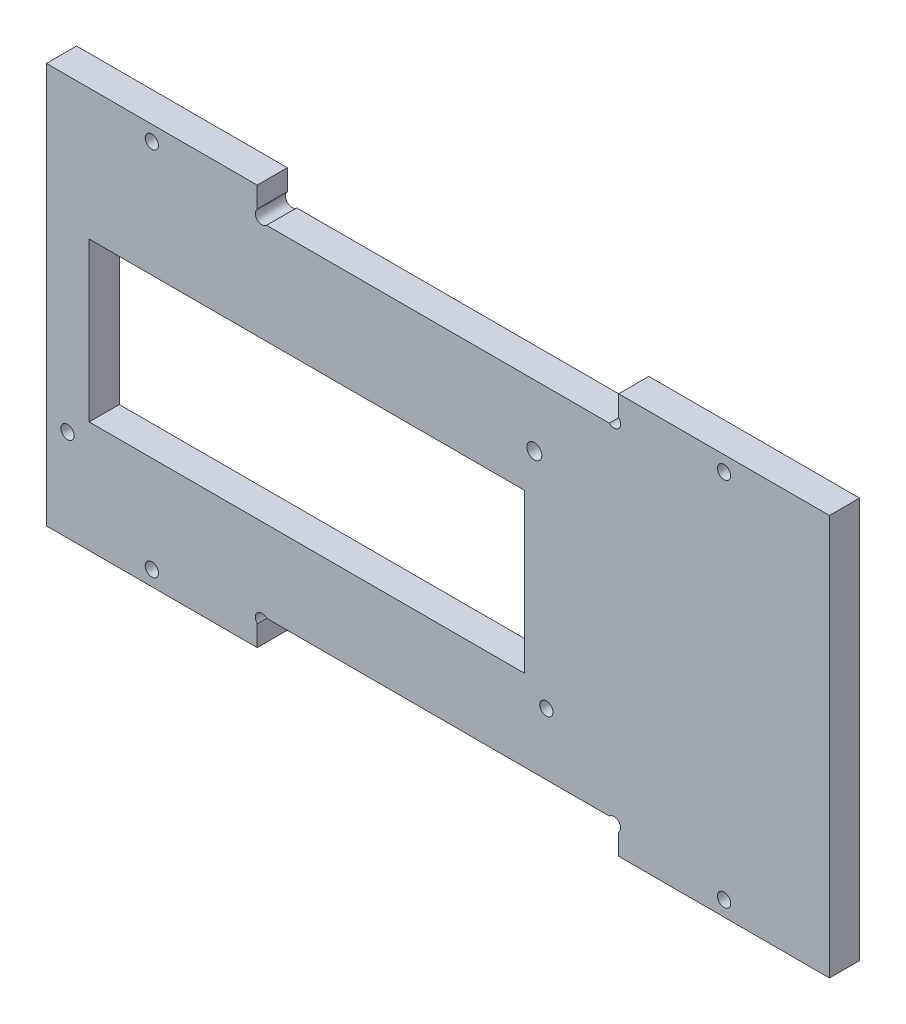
SolidWorks part; units mm, degrees
ref_plane "Plan de face" through (0, 0, 0) normal (0, 0, 1) x (1, 0, 0)
ref_plane "Plan de dessus" through (0, 0, 0) normal (0, 1, 0) x (1, 0, 0)
ref_plane "Plan de droite" through (0, 0, 0) normal (1, 0, 0) x (0, 0, -1)
sketch "Esquisse1" plane through (0, 0, 0) normal (0, 0, 1) x (1, 0, 0)
  line L1 (0, 0) -> (130, 0)
  line L2 (0, 0) -> (0, 66.5)
  line L3 (0, 66.5) -> (130, 66.5)
  line L4 (130, 0) -> (130, 66.5)
  dimension "D1" = 130
  dimension "D2" = 66.5
extrude "Boss.-Extru.1" add sketch "Esquisse1" along normal blind 5
sketch "Esquisse2" plane through (0, 0, 5) normal (0, 0, 1) x (1, 0, 0)
  line L0 (0, 66.5) -> (0, 0) construction
  line L1 (130, 66.5) -> (0, 66.5) construction
  line L2 (83, 15.25) -> (3.5, 15.25) construction
  line L3 (5.5, 51.25) -> (81, 51.25) construction
  circle A0 centre (81, 51.25) radius 1.25
  circle A2 centre (83, 15.25) radius 1.1
  circle A3 centre (3.5, 15.25) radius 1.1
  point P2 (5.5, 51.25)
  dimension "D1" = 2.5
  dimension "D2" = 79.5
  dimension "D6" = 2.2
  dimension "D7" = 2.2
  dimension "D3" = 36
  dimension "D4" = 81
  dimension "D5" = 15.25
  dimension "D8" = 75.5
  dimension "D9" = 3.5
extrude "Enlèv. mat.-Extru.1" cut sketch "Esquisse2" against normal up to next
sketch "Esquisse3" plane through (0, 0, 5) normal (0, 0, 1) x (1, 0, 0)
  line L1 (79.4, 18.5) -> (7.1, 18.5)
  line L2 (79.4, 18.5) -> (79.4, 44.8)
  line L3 (79.4, 44.8) -> (7.1, 44.8)
  line L4 (7.1, 18.5) -> (7.1, 44.8)
  circle A1 centre (81, 51.25) radius 1.25 construction
  dimension "D3" = 1.6
  dimension "D1" = 26.3
  dimension "D2" = 72.3
  dimension "D4" = 6.45
extrude "Enlèv. mat.-Extru.2" cut sketch "Esquisse3" against normal up to next
sketch "Esquisse5" plane through (0, 0, 5) normal (0, 0, 1) x (1, 0, 0)
  circle A0 centre (83, 15.25) radius 2
  circle A1 centre (81, 51.25) radius 2
  circle A2 centre (3.5, 15.25) radius 2
  dimension "D1" = 4
  dimension "D2" = 4
  dimension "D3" = 4
extrude "Enlèv. mat.-Extru.3" [suppressed] cut sketch "Esquisse5" against normal blind 1.5
sketch "Esquisse6" plane through (0, 0, 5) normal (0, 0, 1) x (1, 0, 0)
  line L0 (0, 0) -> (130, 0) construction
  line L1 (95, 0) -> (35, 0)
  line L2 (95, 0) -> (95, 5)
  line L3 (95, 5) -> (35, 5)
  line L4 (35, 0) -> (35, 5)
  line L5 (130, 66.5) -> (0, 66.5) construction
  line L6 (95, 66.5) -> (35, 66.5)
  line L7 (95, 66.5) -> (95, 61.5)
  line L8 (95, 61.5) -> (35, 61.5)
  line L9 (35, 66.5) -> (35, 61.5)
  line L10 (130, 0) -> (130, 66.5) construction
  dimension "D1" = 5
  dimension "D2" = 5
  dimension "D3" = 60
  dimension "D4" = 60
  dimension "D5" = 35
  dimension "D6" = 35
extrude "Enlèv. mat.-Extru.4" cut sketch "Esquisse6" against normal up to next
sketch "Esquisse7" plane through (0, 0, 5) normal (0, 0, 1) x (1, 0, 0)
  line L0 (35, 5) -> (53.0632, -13.0632) construction
  line L1 (95, 5) -> (72.5313, -17.4687) construction
  line L2 (35, 61.5) -> (56.3913, 82.8913) construction
  line L3 (95, 61.5) -> (70.0123, 86.4877) construction
  line L4 (95, 5) -> (35, 5) construction
  line L5 (35, 61.5) -> (95, 61.5) construction
  circle A0 centre (94.2222, 4.2222) radius 1.1
  circle A1 centre (35.7778, 4.2222) radius 1.1
  circle A2 centre (35.7778, 62.2778) radius 1.1
  circle A3 centre (94.2222, 62.2778) radius 1.1
  dimension "D5" = 2.2
  dimension "D6" = 2.2
  dimension "D7" = 2.2
  dimension "D8" = 2.2
  dimension "D1" = 45
  dimension "D2" = 45
  dimension "D3" = 45
  dimension "D4" = 45
extrude "Enlèv. mat.-Extru.5" cut sketch "Esquisse7" against normal up to next
ref_plane "Plan1" through (65, 0, 0) normal (1, 0, 0) x (0, 0, -1)
ref_plane "Plan2" through (0, 33.25, 0) normal (0, 1, 0) x (-1, 0, 0)
sketch "Esquisse8" plane through (0, 0, 5) normal (0, 0, 1) x (1, 0, 0)
  line L0 (0, 0) -> (35, 0) construction
  line L1 (17.5, 0) -> (17.5, 12.6912) construction
  circle A0 centre (17.5, 2.5) radius 1.1
  dimension "D2" = 2.2
  dimension "D1" = 2.5
extrude "Enlèv. mat.-Extru.6" cut sketch "Esquisse8" against normal up to next
mirror "Symétrie1" about plane through (65, 0, 0) normal (1, 0, 0) of "Enlèv. mat.-Extru.6"
mirror "Symétrie2" about plane through (0, 33.25, 0) normal (0, 1, 0) of "Symétrie1", "Enlèv. mat.-Extru.6"
sketch "Esquisse10" plane through (0, 0, 0) normal (0, 0, -1) x (-1, 0, 0)
  line L0 (-79.4, 18.5) -> (-79.4, 44.8) construction
  line L1 (-78.4, 48.3) -> (-38.4, 48.3)
  line L2 (-78.4, 48.3) -> (-78.4, 54.8)
  line L3 (-78.4, 54.8) -> (-38.4, 54.8)
  line L4 (-38.4, 48.3) -> (-38.4, 54.8)
  line L5 (-79.4, 44.8) -> (-7.1, 44.8) construction
  dimension "D1" = 40
  dimension "D2" = 6.5
  dimension "D3" = 1
  dimension "D4" = 3.5
extrude "Enlèv. mat.-Extru.7" cut sketch "Esquisse10" against normal blind 1
